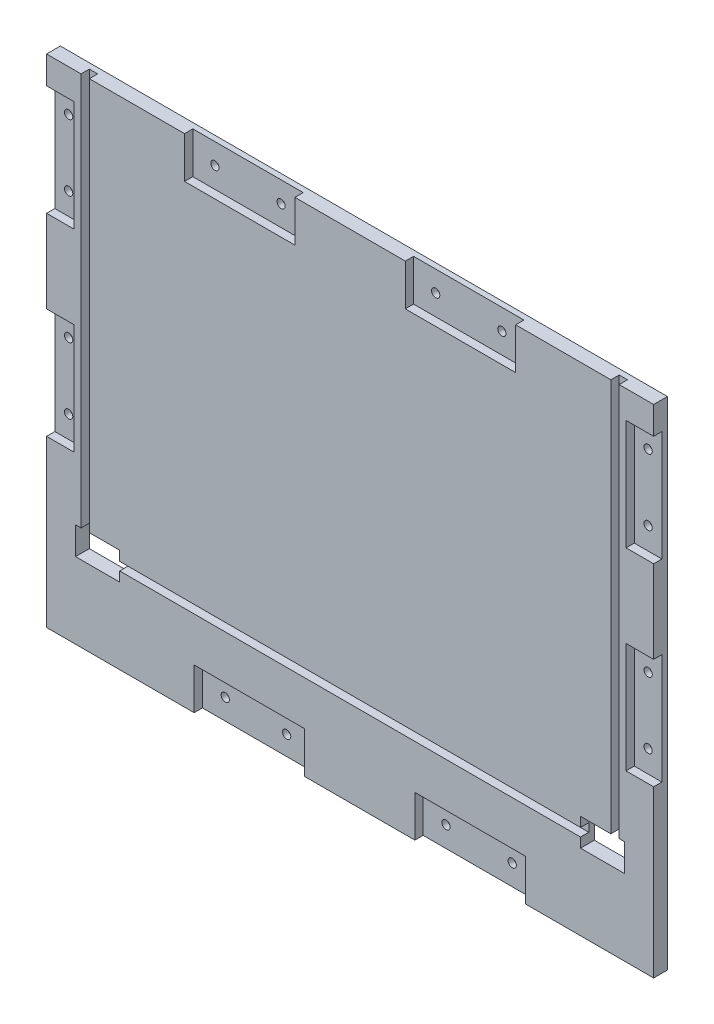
SolidWorks part; units mm, degrees
ref_plane "Plan de face" through (0, 0, 0) normal (0, 0, 1) x (1, 0, 0)
ref_plane "Plan de dessus" through (0, 0, 0) normal (0, 1, 0) x (1, 0, 0)
ref_plane "Plan de droite" through (0, 0, 0) normal (1, 0, 0) x (0, 0, -1)
sketch "Esquisse1" plane through (0, 0, 0) normal (0, 0, 1) x (1, 0, 0)
  line L0 (110, 200) -> (110, -40) construction
  line L1 (0, 0) -> (220, 0)
  line L2 (0, 0) -> (0, 180)
  line L3 (0, 180) -> (220, 180)
  line L4 (220, 0) -> (220, 180)
  line L5 (193.5, 37.5) -> (209.5, 37.5)
  line L6 (193.5, 37.5) -> (193.5, 27.5)
  line L7 (193.5, 27.5) -> (209.5, 27.5)
  line L8 (209.5, 37.5) -> (209.5, 27.5)
  line L9 (10.5, 37.5) -> (10.5, 27.5)
  line L10 (26.5, 27.5) -> (10.5, 27.5)
  line L11 (26.5, 37.5) -> (26.5, 27.5)
  line L12 (26.5, 37.5) -> (10.5, 37.5)
  dimension "D1" = 220
  dimension "D2" = 180
  dimension "D3" = 110
  dimension "D5" = 16
  dimension "D6" = 10
  dimension "D7" = 99.5
  dimension "D8" = 142.5
extrude "Extrusion1" add sketch "Esquisse1" along normal blind 5
sketch "Esquisse2" plane through (0, 0, 5) normal (0, 0, 1) x (1, 0, 0)
  line L0 (26.5, 27.5) -> (26.5, 37.5) construction
  line L1 (26.5, 34) -> (193.5, 34)
  line L2 (26.5, 34) -> (26.5, 31)
  line L3 (26.5, 31) -> (193.5, 31)
  line L4 (193.5, 34) -> (193.5, 31)
  line L5 (193.5, 37.5) -> (193.5, 27.5) construction
  line L6 (110, 222) -> (110, -37) construction
  line L7 (0, 180) -> (0, 0) construction
  line L8 (209.5, 37.5) -> (193.5, 37.5) construction
  line L9 (204.5, 37.5) -> (207.5, 37.5)
  line L10 (204.5, 37.5) -> (204.5, 180)
  line L11 (204.5, 180) -> (207.5, 180)
  line L12 (207.5, 37.5) -> (207.5, 180)
  line L13 (220, 180) -> (0, 180) construction
  line L14 (12.5, 37.5) -> (12.5, 180)
  line L15 (15.5, 180) -> (12.5, 180)
  line L16 (15.5, 37.5) -> (15.5, 180)
  line L17 (15.5, 37.5) -> (12.5, 37.5)
  dimension "D1" = 3
  dimension "D2" = 3.5
  dimension "D3" = 2
  dimension "D4" = 110
extrude "Enlèv. mat.-Extru.1" cut sketch "Esquisse2" against normal blind 3
sketch "Esquisse3" plane through (0, 0, 5) normal (0, 0, 1) x (1, 0, 0)
  line L0 (110, 132.1597) -> (110, -114.8403) construction
  line L1 (130, 180) -> (170, 180)
  line L2 (130, 165) -> (170, 165)
  line L3 (220, 170) -> (210, 170)
  line L4 (220, 170) -> (220, 130)
  line L5 (220, 130) -> (210, 130)
  line L6 (210, 170) -> (210, 130)
  line L7 (-35.6619, 115) -> (238.3381, 115) construction
  line L8 (150, 196) -> (150, 140) construction
  line L9 (130, 180) -> (130, 165)
  line L10 (170, 180) -> (170, 165)
  line L11 (133.4814, 15) -> (173.4814, 15)
  line L12 (0, 180) -> (0, 0) construction
  line L13 (210, 60) -> (210, 100)
  line L14 (220, 100) -> (210, 100)
  line L15 (220, 60) -> (220, 100)
  line L16 (220, 60) -> (210, 60)
  line L17 (204.5, 180) -> (15.5, 180) construction
  line L18 (133.4814, 0) -> (173.4814, 0)
  line L19 (133.4814, 15) -> (133.4814, 0)
  line L20 (173.4814, 15) -> (173.4814, 0)
  line L21 (53.4814, 15) -> (53.4814, 0)
  line L22 (93.4814, 15) -> (93.4814, 0)
  line L23 (93.4814, 0) -> (53.4814, 0)
  line L24 (93.4814, 15) -> (53.4814, 15)
  line L25 (0, 60) -> (10, 60)
  line L26 (0, 60) -> (0, 100)
  line L27 (0, 100) -> (10, 100)
  line L28 (10, 60) -> (10, 100)
  line L29 (10, 170) -> (10, 130)
  line L30 (0, 130) -> (10, 130)
  line L31 (0, 170) -> (0, 130)
  line L32 (0, 170) -> (10, 170)
  line L33 (50, 180) -> (50, 165)
  line L34 (90, 180) -> (90, 165)
  line L35 (90, 165) -> (50, 165)
  line L36 (90, 180) -> (50, 180)
  line L37 (204.5, 180) -> (15.5, 180) construction
  dimension "D1" = 15
  dimension "D2" = 20
  dimension "D3" = 40
  dimension "D4" = 10
  dimension "D5" = 40
  dimension "D6" = 15
  dimension "D7" = 65
  dimension "D8" = 110
extrude "Enlèv. mat.-Extru.2" cut sketch "Esquisse3" against normal blind 3
sketch "Esquisse4" plane through (0, 0, 5) normal (0, 0, 1) x (1, 0, 0)
  line L0 (150, 186) -> (150, 158) construction
  line L1 (130, 180) -> (130, 165) construction
  line L2 (170, 180) -> (130, 180) construction
  line L3 (201, 150) -> (228, 150) construction
  line L4 (220, 170) -> (210, 170) construction
  line L5 (220, 130) -> (220, 170) construction
  line L6 (-25, 115) -> (246, 115) construction
  line L7 (204.5, 180) -> (170, 180) construction
  line L8 (110, 217) -> (110, -27) construction
  line L9 (220, 0) -> (220, 60) construction
  line L10 (19, 150) -> (-8, 150) construction
  line L11 (70, 186) -> (70, 158) construction
  circle A0 centre (138, 172.5) radius 1.5
  circle A1 centre (162, 172.5) radius 1.5
  circle A2 centre (215, 162) radius 1.5
  circle A3 centre (215, 138) radius 1.5
  circle A4 centre (215, 92) radius 1.5
  circle A5 centre (215, 68) radius 1.5
  circle A6 centre (141.7537, 7.4796) radius 1.5
  circle A7 centre (165.7537, 7.4796) radius 1.5
  circle A8 centre (61.7537, 7.4796) radius 1.5
  circle A9 centre (84, 7) radius 1.5
  circle A10 centre (5, 68) radius 1.5
  circle A11 centre (5, 92) radius 1.5
  circle A12 centre (5, 138) radius 1.5
  circle A13 centre (5, 162) radius 1.5
  circle A14 centre (58, 172.5) radius 1.5
  circle A15 centre (82, 172.5) radius 1.5
  dimension "D5" = 5
  dimension "D1" = 20
  dimension "D2" = 7.5
  dimension "D3" = 12
  dimension "D4" = 20
  dimension "D6" = 12
  dimension "D7" = 65
  dimension "D8" = 110
extrude "Enlèv. mat.-Extru.3" cut sketch "Esquisse4" against normal through all
